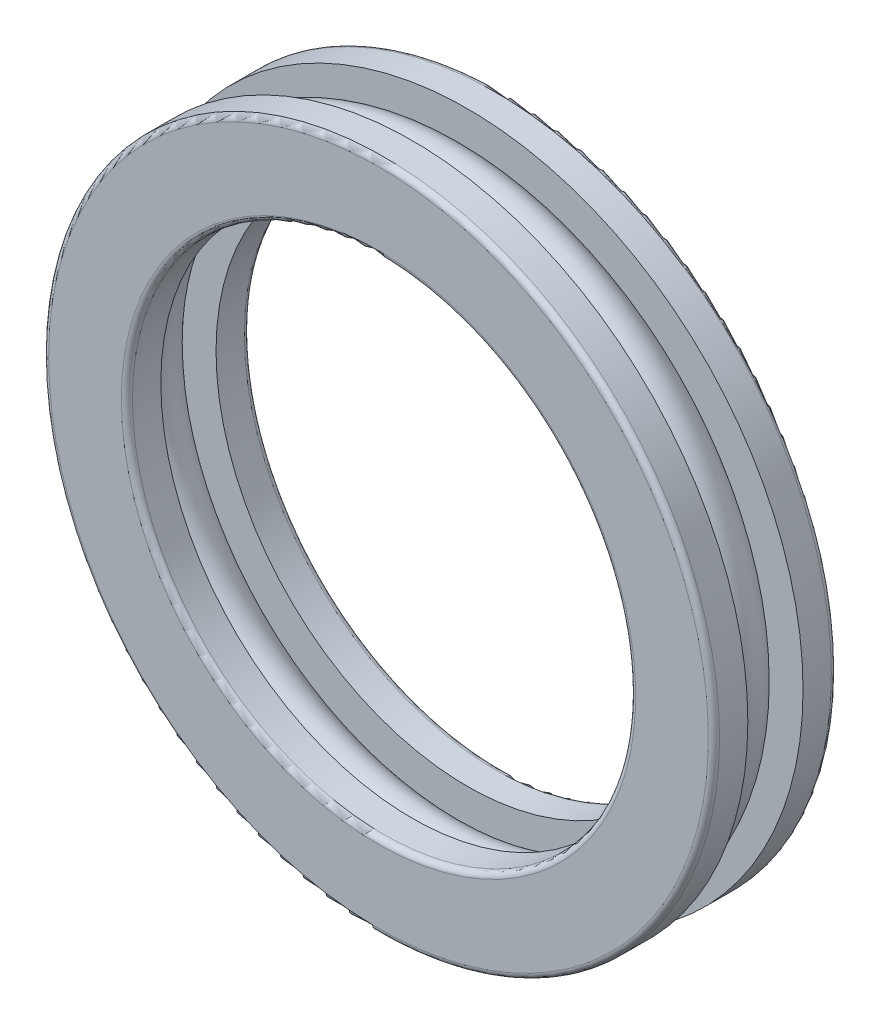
SolidWorks part; units mm, degrees
ref_plane "Спереди" through (0, 0, 0) normal (0, 0, 1) x (1, 0, 0)
ref_plane "Сверху" through (0, 0, 0) normal (0, 1, 0) x (1, 0, 0)
ref_plane "Справа" through (0, 0, 0) normal (1, 0, 0) x (0, 0, -1)
sketch "Эскиз1" plane through (0, 0, 0) normal (0, 1, 0) x (1, 0, 0)
  line L0 (0, 0) -> (0, 27.6874) construction
  line L1 (-60, 22) -> (-45, 0) construction
  line L2 (-60, 0) -> (-45, 0)
  line L3 (-60, 0) -> (-60, 6.0623)
  line L4 (-60, 6.0623) -> (-45, 6.0623)
  line L5 (-45, 0) -> (-45, 6.0623)
  line L6 (-60, 22) -> (-45, 22)
  line L7 (-60, 22) -> (-60, 15.9377)
  line L8 (-60, 15.9377) -> (-45, 15.9377)
  line L9 (-45, 22) -> (-45, 15.9377)
  circle A0 centre (-52.5, 11) radius 4.519
  dimension "D1" = 120
  dimension "D2" = 90
  dimension "D3" = 22
revolve "Повернуть1" add sketch "Эскиз1" angle 360 about L0
fillet "Скругление1" radius 1 2 edges at (60, 0, 0) (45, 0, 0)
fillet "Скругление2" radius 1 2 edges at (45, 0, -22) (60, 0, -22)
